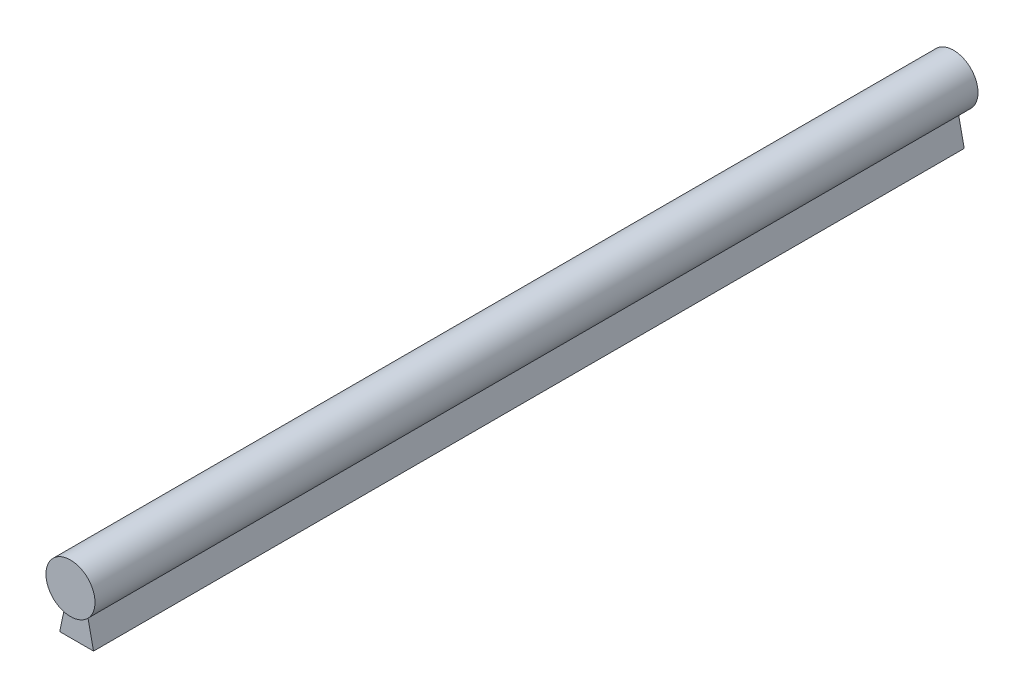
SolidWorks part; units mm, degrees
ref_plane "front" through (0, 0, 0) normal (0, 0, 1) x (1, 0, 0)
ref_plane "top" through (0, 0, 0) normal (0, 1, 0) x (1, 0, 0)
ref_plane "side" through (0, 0, 0) normal (1, 0, 0) x (0, 0, -1)
sketch "Sketch1" plane through (0, 0, 0) normal (0, 0, 1) x (1, 0, 0)
  circle A0 centre (0, 0) radius 12.7
  dimension "D1" = 25.4
extrude "Base-Extrude" add sketch "Sketch1" along normal blind 457.2
ref_plane "Plane4" through (0, 0, 3.175) normal (0, 0, 1) x (1, 0, 0)
sketch "Sketch2" plane through (0, 0, 3.175) normal (0, 0, 1) x (1, 0, 0)
  line L0 (0, 0) -> (0, -25.4) construction
  line L1 (-8.763, -25.4) -> (8.763, -25.4)
  line L2 (8.763, -25.4) -> (5.769, -11.3141)
  line L3 (8.763, -25.4) -> (8.763, -14.2842) construction
  line L4 (-8.763, -25.4) -> (-5.769, -11.3141)
  circle A0 centre (0, 0) radius 12.7 construction
  arc A1 (-5.769, -11.3141) -> (5.769, -11.3141) centre (0, 0) ccw
  point P9 (0, -25.4)
  dimension "D1" = 12
  dimension "D2" = 25.4
  dimension "D3" = 17.526
extrude "Boss-Extrude1" add sketch "Sketch2" along normal blind 450.85
